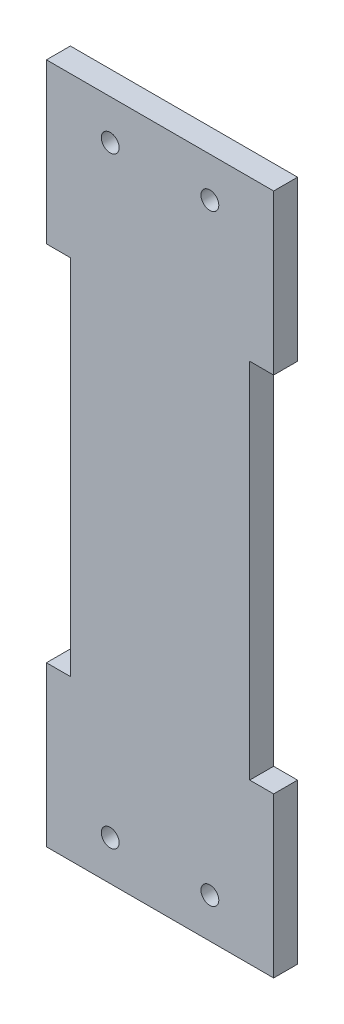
SolidWorks part; units mm, degrees
ref_plane "Plan de face" through (0, 0, 0) normal (0, 0, 1) x (1, 0, 0)
ref_plane "Plan de dessus" through (0, 0, 0) normal (0, 1, 0) x (1, 0, 0)
ref_plane "Plan de droite" through (0, 0, 0) normal (1, 0, 0) x (0, 0, -1)
sketch "Esquisse1" plane through (0, 0, 0) normal (0, 0, 1) x (1, 0, 0)
  line L1 (-22.5, 85.5) -> (22.5, 85.5)
  line L2 (-22.5, 85.5) -> (-22.5, -85.5)
  line L3 (-22.5, -85.5) -> (22.5, -85.5)
  line L4 (22.5, 85.5) -> (22.5, -85.5)
  line L5 (-22.5, 85.5) -> (22.5, -85.5) construction
  line L6 (-22.5, -85.5) -> (22.5, 85.5) construction
  point P0 (0, 0)
  dimension "D1" = 45
  dimension "D2" = 171
extrude "Boss.-Extru.1" add sketch "Esquisse1" along normal blind 6
sketch "Esquisse2" plane through (0, 0, 6) normal (0, 0, 1) x (1, 0, 0)
  line L1 (-22.5, 85.5) -> (-28.5, 85.5)
  line L2 (-22.5, 85.5) -> (-22.5, 45.5)
  line L3 (-22.5, 45.5) -> (-28.5, 45.5)
  line L4 (-28.5, 85.5) -> (-28.5, 45.5)
  dimension "D1" = 40
  dimension "D2" = 6
extrude "Boss.-Extru.2" add sketch "Esquisse2" against normal blind 6
sketch "Esquisse4" plane through (0, 0, 6) normal (0, 0, 1) x (1, 0, 0)
  line L0 (-22.5, 45.5) -> (-22.5, -85.5) construction
  line L1 (-22.5, -85.5) -> (22.5, -85.5) construction
  circle A0 centre (-12.5, -75.5) radius 2.2347
  dimension "D1" = 10
  dimension "D2" = 10
extrude "Enlèv. mat.-Extru.1" cut sketch "Esquisse4" against normal blind 6
mirror "Symétrie1" about plane through (0, 0, 0) normal (1, 0, 0) of "Enlèv. mat.-Extru.1"
mirror "Symétrie2" about plane through (0, 0, 0) normal (1, 0, 0) of "Boss.-Extru.2"
mirror "Symétrie3" about plane through (0, 0, 0) normal (0, 1, 0) of "Symétrie2", "Boss.-Extru.2"
mirror "Symétrie4" about plane through (0, 0, 0) normal (0, 1, 0) of "Symétrie1", "Enlèv. mat.-Extru.1"
